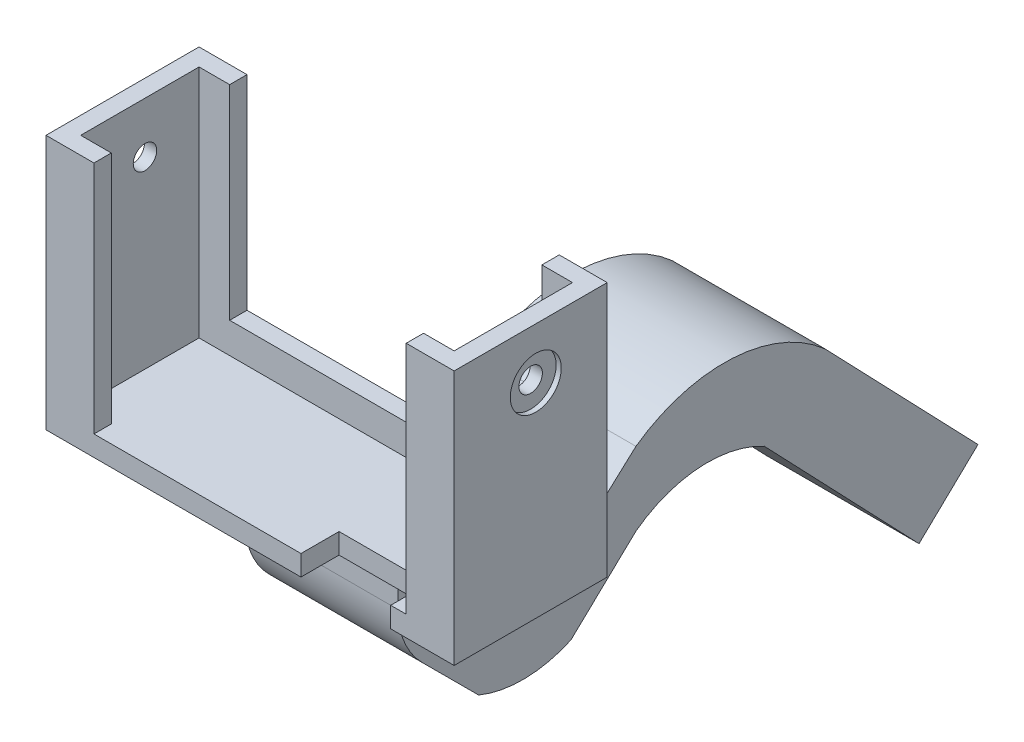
SolidWorks part; units mm, degrees
ref_plane "前视基准面" through (0, 0, 0) normal (0, 0, 1) x (1, 0, 0)
ref_plane "上视基准面" through (0, 0, 0) normal (0, 1, 0) x (1, 0, 0)
ref_plane "右视基准面" through (0, 0, 0) normal (1, 0, 0) x (0, 0, -1)
other "Configuration Table"
sketch "草图1" plane through (0, 0, 0) normal (0, 1, 0) x (1, 0, 0)
  line L5 (-7.5, 4) -> (7.5, 4)
  line L6 (-7.5, 4) -> (-7.5, -4)
  line L7 (-7.5, -4) -> (7.5, -4)
  line L8 (7.5, 4) -> (7.5, -4)
  line L9 (-7.5, 4) -> (7.5, -4) construction
  line L10 (-7.5, -4) -> (7.5, 4) construction
  point P0 (0, 0)
  dimension "D1" = 8
  dimension "D2" = 15
extrude "凸台-拉伸1" add sketch "草图1" along normal blind 7
sketch "草图4" plane through (0, 7, 0) normal (0, 1, 0) x (1, 0, 0)
  line L1 (-20, 4) -> (20, 4)
  line L2 (-20, 4) -> (-20, -11)
  line L3 (-20, -11) -> (20, -11)
  line L4 (20, 4) -> (20, -11)
  line L5 (-20, 4) -> (20, -11) construction
  line L6 (-20, -11) -> (20, 4) construction
  line L7 (7.5, 4) -> (-7.5, 4) construction
  point P0 (0, -3.5)
  dimension "D1" = 40
  dimension "D2" = 15
extrude "凸台-拉伸3" add sketch "草图4" against normal blind 2
sketch "草图5" plane through (0, 7, 0) normal (0, 1, 0) x (1, 0, 0)
  line L1 (-20, 4) -> (20, 4)
  line L2 (-20, 4) -> (-20, -11)
  line L3 (-20, -11) -> (20, -11)
  line L4 (20, 4) -> (20, -11)
  line L5 (-20, 4) -> (20, -11) construction
  line L6 (-20, -11) -> (20, 4) construction
  line L7 (-18.3, 2.3) -> (18.3, 2.3)
  line L8 (-18.3, 2.3) -> (-18.3, -9.3)
  line L9 (-18.3, -9.3) -> (18.3, -9.3)
  line L10 (18.3, 2.3) -> (18.3, -9.3)
  line L11 (-18.3, 2.3) -> (18.3, -9.3) construction
  line L12 (-18.3, -9.3) -> (18.3, 2.3) construction
  point P0 (0, -3.5)
  point P7 (0, -3.5)
  dimension "D1" = 36.6
  dimension "D2" = 11.6
extrude "凸台-拉伸4" add sketch "草图5" along normal blind 23
sketch "草图6" plane through (0, 0, -4) normal (0, 0, -1) x (-1, 0, 0)
  line L0 (-20, 30) -> (20, 30) construction
  line L1 (-15.3, 30) -> (15.3, 30)
  line L2 (-15.3, 30) -> (-15.3, 10)
  line L3 (-15.3, 10) -> (15.3, 10)
  line L4 (15.3, 30) -> (15.3, 10)
  line L5 (-18.3, 30) -> (-18.3, 7) construction
  line L7 (18.3, 30) -> (18.3, 7) construction
  line L8 (18.3, 7) -> (-18.3, 7) construction
  dimension "D1" = 3
  dimension "D2" = 3
  dimension "D3" = 3
extrude "切除-拉伸1" cut sketch "草图6" against normal through all
sketch "草图7" plane through (0, 0, 11) normal (0, 0, 1) x (1, 0, 0)
  line L0 (18.3, 7) -> (-18.3, 7) construction
  line L1 (15.3, 10) -> (-15.3, 10)
  line L2 (15.3, 10) -> (15.3, 7)
  line L3 (15.3, 7) -> (-15.3, 7)
  line L4 (-15.3, 10) -> (-15.3, 7)
  line L6 (15.3, 10) -> (-15.3, 10) construction
  line L7 (-15.3, 10) -> (-15.3, 30) construction
extrude "切除-拉伸2" cut sketch "草图7" against normal up to next
sketch "草图8" plane through (-20, 0, 0) normal (-1, 0, 0) x (0, 0, 1)
  line L0 (9.3, 7) -> (-2.3, 7) construction
  line L1 (-4, 30) -> (11, 30) construction
  circle A0 centre (3, 25) radius 1.15
  point P8 (3.5, 30)
  dimension "D1" = 2.3
  dimension "D2" = 18
  dimension "D3" = 0.5
extrude "切除-拉伸3" cut sketch "草图8" against normal up to next
sketch "草图9" plane through (-20, 0, 0) normal (-1, 0, 0) x (0, 0, 1)
  circle A0 centre (3, 25) radius 2.5
extrude "切除-拉伸4" cut sketch "草图9" against normal blind 0.5
mirror "镜向2" about plane through (0, 0, 0) normal (1, 0, 0) of "切除-拉伸4", "切除-拉伸3"
sketch "草图11" plane through (-7.5, 0, 0) normal (-1, 0, 0) x (0, 0, 1)
  line L0 (4, 0) -> (-4, 0)
  line L1 (-4, 0) -> (1.6569, -5.6569) construction
  line L11 (-47.0602, -19.9419) -> (-52.8416, -14.4124)
  line L19 (-4, 0) -> (-7.2392, -3.1484)
  line L20 (-3.9046, -11.214) -> (1.6569, -5.6569)
  line L23 (-52.8416, -14.4124) -> (-37.8533, 1.1938)
  line L24 (-19.318, 2.1932) -> (-12.9438, -3.6212)
  line L25 (-12.9438, -11.0595) -> (-19.318, -5.0045)
  line L26 (-31.9013, -4.0926) -> (-47.0602, -19.9419)
  arc A0 (4, 0) -> (1.6569, -5.6569) centre (-4, 0) cw
  arc A2 (-12.9438, -11.0595) -> (-3.9046, -11.214) centre (-8.2464, -0.7297) ccw
  arc A3 (-12.9438, -3.6212) -> (-7.2392, -3.1484) centre (-10.5831, 2.5472) ccw
  arc A5 (-19.318, -5.0045) -> (-31.9013, -4.0926) centre (-26.3245, -14.4124) ccw
  arc A6 (-19.318, 2.1932) -> (-37.8533, 1.1938) centre (-27.9587, -9.9343) ccw
  dimension "D3" = 11.7303
  dimension "D1" = 45
  dimension "D2" = 21.638
  dimension "D4" = 8.7917
  dimension "D5" = 8
  dimension "D6" = 33.0799
  dimension "D7" = 44.1743
extrude "凸台-拉伸6" add sketch "草图11" against normal up to surface (15 mm away)
sketch "草图12" plane through (0, 7, 0) normal (0, 1, 0) x (1, 0, 0)
  line L0 (-15.3, -11) -> (15.3, -11) construction
  line L1 (13.7805, -11) -> (4.99, -11)
  line L2 (13.7805, -11) -> (13.7805, -7.2685)
  line L3 (13.7805, -7.2685) -> (4.99, -7.2685)
  line L4 (4.99, -11) -> (4.99, -7.2685)
extrude "切除-拉伸5" cut sketch "草图12" against normal blind 10
sketch "草图13" plane through (0, -8.4212, -7.6816) normal (0, 0.7388, 0.6739) x (1, 0, 0)
  circle A0 centre (0, 11.0042) radius 3.5
extrude "切除-拉伸6" cut sketch "草图13" against normal blind 10
